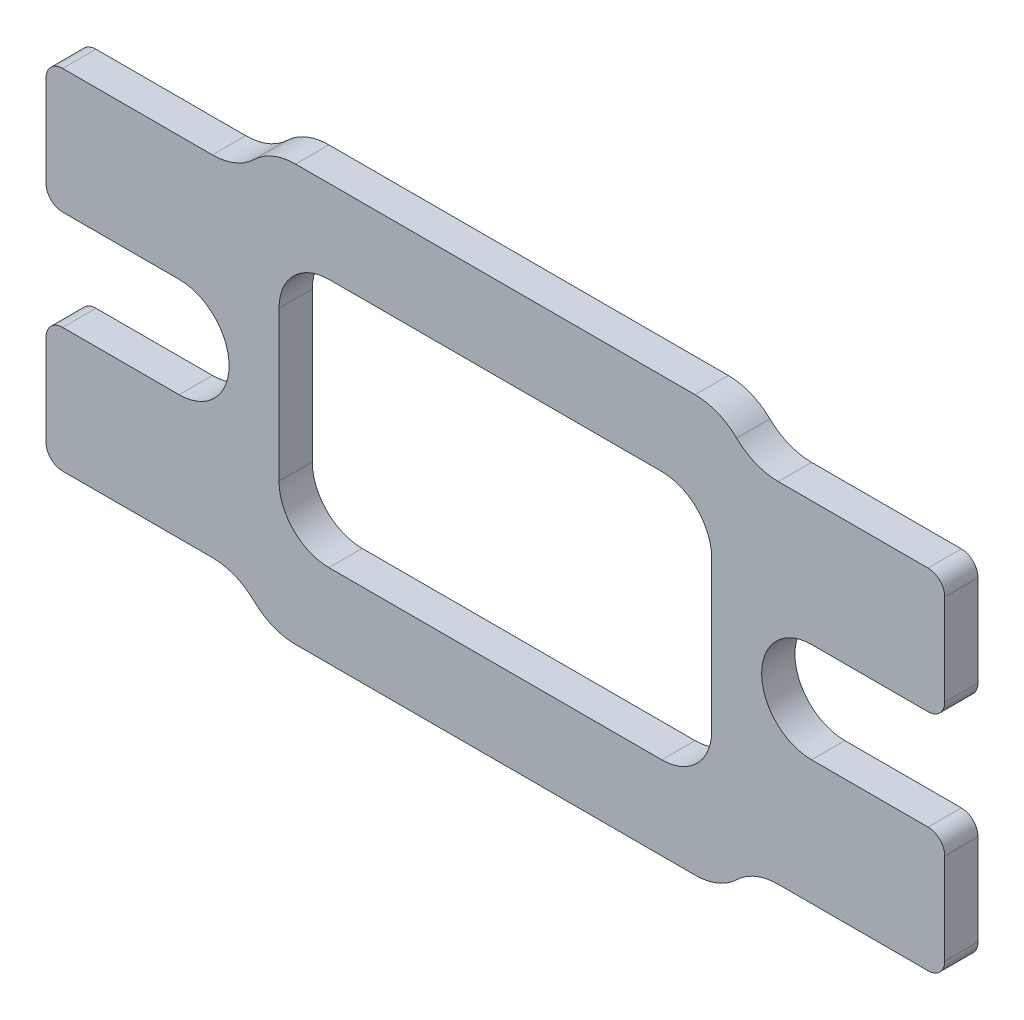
SolidWorks part; units mm, degrees
ref_plane "Plan de face" through (0, 0, 0) normal (0, 0, 1) x (1, 0, 0)
ref_plane "Plan de dessus" through (0, 0, 0) normal (0, 1, 0) x (1, 0, 0)
ref_plane "Plan de droite" through (0, 0, 0) normal (1, 0, 0) x (0, 0, -1)
sketch "Esquisse1" plane through (0, 0, 0) normal (0, 0, 1) x (1, 0, 0)
  line L0 (-13, -69) -> (-13, -60) construction
  line L1 (10, -72) -> (-10, -72) construction
  line L2 (13, -69) -> (13, -60) construction
  line L3 (10, -57) -> (-10, -57) construction
  line L4 (10, -57) -> (-10, -57)
  line L5 (13, -69) -> (13, -60)
  line L6 (10, -72) -> (-10, -72)
  line L7 (-13, -69) -> (-13, -60)
  line L14 (17, -74.9784) -> (26, -74.9784)
  line L15 (27, -73.9784) -> (27, -68.5)
  line L16 (26, -67.5) -> (19, -67.5)
  line L17 (19, -61.5) -> (26, -61.5)
  line L18 (27, -60.5) -> (27, -55.0216)
  line L19 (26, -54.0216) -> (17, -54.0216)
  line L20 (12, -52) -> (-12, -52)
  line L21 (-17, -54.0216) -> (-26, -54.0216)
  line L22 (-27, -55.0216) -> (-27, -60.5)
  line L23 (-26, -61.5) -> (-19, -61.5)
  line L24 (-19, -67.5) -> (-26, -67.5)
  line L25 (-27, -68.5) -> (-27, -73.9784)
  line L26 (-26, -74.9784) -> (-17, -74.9784)
  line L27 (-12, -77) -> (12, -77)
  line L28 (17, -74.9784) -> (26, -74.9784)
  line L29 (27, -73.9784) -> (27, -68.5)
  line L30 (26, -67.5) -> (19, -67.5)
  line L31 (19, -61.5) -> (26, -61.5)
  line L32 (27, -60.5) -> (27, -55.0216)
  line L33 (26, -54.0216) -> (17, -54.0216)
  line L34 (12, -52) -> (-12, -52)
  line L35 (-17, -54.0216) -> (-26, -54.0216)
  line L36 (-27, -55.0216) -> (-27, -60.5)
  line L37 (-26, -61.5) -> (-19, -61.5)
  line L38 (-19, -67.5) -> (-26, -67.5)
  line L39 (-27, -68.5) -> (-27, -73.9784)
  line L40 (-26, -74.9784) -> (-17, -74.9784)
  line L41 (-12, -77) -> (12, -77)
  arc A0 (10, -72) -> (13, -69) centre (10, -69) ccw construction
  arc A1 (-13, -69) -> (-10, -72) centre (-10, -69) ccw construction
  arc A2 (-10, -57) -> (-13, -60) centre (-10, -60) ccw construction
  arc A3 (13, -60) -> (10, -57) centre (10, -60) ccw construction
  arc A4 (10, -72) -> (13, -69) centre (10, -69) ccw
  arc A5 (13, -60) -> (10, -57) centre (10, -60) ccw
  arc A6 (-10, -57) -> (-13, -60) centre (-10, -60) ccw
  arc A7 (-13, -69) -> (-10, -72) centre (-10, -69) ccw
  arc A18 (12, -77) -> (14.5, -75.9892) centre (12, -73.403) ccw
  arc A19 (17, -74.9784) -> (14.5, -75.9892) centre (17, -78.5754) ccw
  arc A20 (26, -74.9784) -> (27, -73.9784) centre (26, -73.9784) ccw
  arc A21 (27, -68.5) -> (26, -67.5) centre (26, -68.5) ccw
  arc A22 (19, -61.5) -> (19, -67.5) centre (19, -64.5) ccw
  arc A23 (26, -61.5) -> (27, -60.5) centre (26, -60.5) ccw
  arc A24 (27, -55.0216) -> (26, -54.0216) centre (26, -55.0216) ccw
  arc A25 (14.5, -53.0108) -> (17, -54.0216) centre (17, -50.4246) ccw
  arc A26 (14.5, -53.0108) -> (12, -52) centre (12, -55.597) ccw
  arc A27 (-12, -52) -> (-14.5, -53.0108) centre (-12, -55.597) ccw
  arc A28 (-17, -54.0216) -> (-14.5, -53.0108) centre (-17, -50.4246) ccw
  arc A29 (-26, -54.0216) -> (-27, -55.0216) centre (-26, -55.0216) ccw
  arc A30 (-27, -60.5) -> (-26, -61.5) centre (-26, -60.5) ccw
  arc A31 (-19, -67.5) -> (-19, -61.5) centre (-19, -64.5) ccw
  arc A32 (-26, -67.5) -> (-27, -68.5) centre (-26, -68.5) ccw
  arc A33 (-27, -73.9784) -> (-26, -74.9784) centre (-26, -73.9784) ccw
  arc A34 (-14.5, -75.9892) -> (-17, -74.9784) centre (-17, -78.5754) ccw
  arc A35 (-14.5, -75.9892) -> (-12, -77) centre (-12, -73.403) ccw
  arc A36 (12, -77) -> (14.5, -75.9892) centre (12, -73.403) ccw
  arc A37 (17, -74.9784) -> (14.5, -75.9892) centre (17, -78.5754) ccw
  arc A38 (26, -74.9784) -> (27, -73.9784) centre (26, -73.9784) ccw
  arc A39 (27, -68.5) -> (26, -67.5) centre (26, -68.5) ccw
  arc A40 (19, -61.5) -> (19, -67.5) centre (19, -64.5) ccw
  arc A41 (26, -61.5) -> (27, -60.5) centre (26, -60.5) ccw
  arc A42 (27, -55.0216) -> (26, -54.0216) centre (26, -55.0216) ccw
  arc A43 (14.5, -53.0108) -> (17, -54.0216) centre (17, -50.4246) ccw
  arc A44 (14.5, -53.0108) -> (12, -52) centre (12, -55.597) ccw
  arc A45 (-12, -52) -> (-14.5, -53.0108) centre (-12, -55.597) ccw
  arc A46 (-17, -54.0216) -> (-14.5, -53.0108) centre (-17, -50.4246) ccw
  arc A47 (-26, -54.0216) -> (-27, -55.0216) centre (-26, -55.0216) ccw
  arc A48 (-27, -60.5) -> (-26, -61.5) centre (-26, -60.5) ccw
  arc A49 (-19, -67.5) -> (-19, -61.5) centre (-19, -64.5) ccw
  arc A50 (-26, -67.5) -> (-27, -68.5) centre (-26, -68.5) ccw
  arc A51 (-27, -73.9784) -> (-26, -74.9784) centre (-26, -73.9784) ccw
  arc A52 (-14.5, -75.9892) -> (-17, -74.9784) centre (-17, -78.5754) ccw
  arc A53 (-14.5, -75.9892) -> (-12, -77) centre (-12, -73.403) ccw
  dimension "D1" = 0
extrude "Boss.-Extru.1" add sketch "Esquisse1" along normal blind 2
